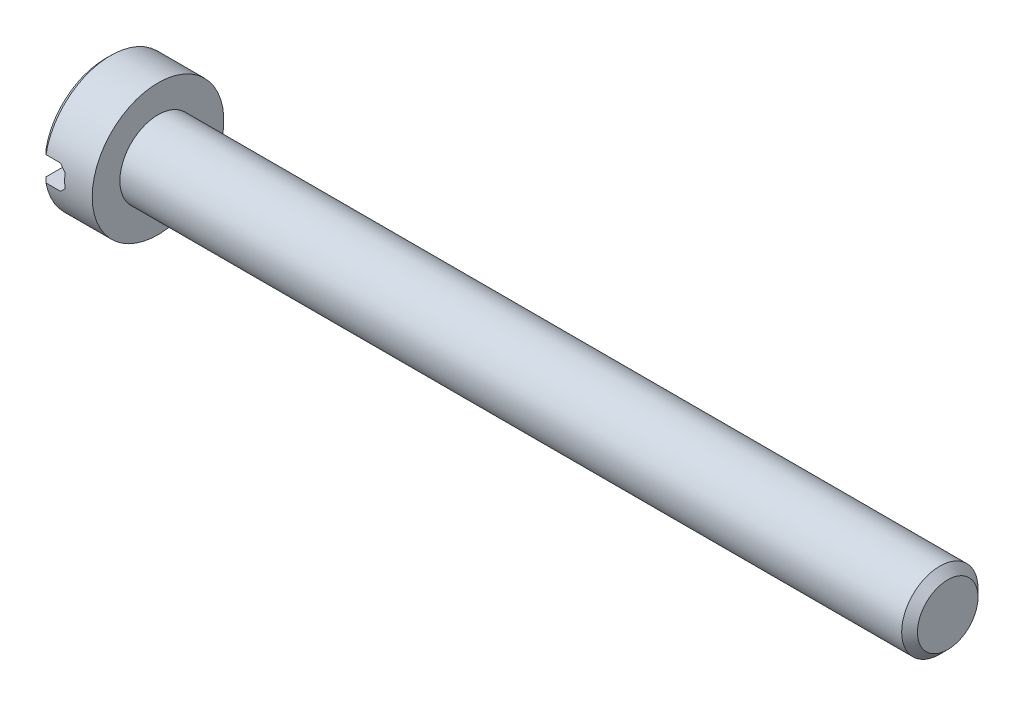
SolidWorks part; units mm, degrees
ref_plane "Face" through (0, 0, 0) normal (0, 0, 1) x (1, 0, 0)
ref_plane "Dessus" through (0, 0, 0) normal (0, 1, 0) x (1, 0, 0)
ref_plane "Droite" through (0, 0, 0) normal (1, 0, 0) x (0, 0, -1)
sketch "Esquisse1" plane through (0, 0, 0) normal (0, 0, 1) x (1, 0, 0)
  line L0 (0, 0) -> (0, 2.3)
  line L1 (0.2, 2.5) -> (2, 2.5)
  line L2 (2, 2.5) -> (2, 0)
  line L5 (0, 0) -> (7.6423, 0) construction
  line L7 (0, 2.3) -> (0.2, 2.5)
  line L8 (0, 0) -> (2, 0)
  point P1 (0, 2.5)
  dimension "D1" = 2.5
  dimension "D3" = 2
revolve "Révolution1" add sketch "Esquisse1" angle 360 about L5
sketch "Esquisse2" plane through (0, 0, 0) normal (0, 0, 1) x (1, 0, 0)
  line L0 (0, 2.3) -> (0, -2.3) construction
  line L1 (0, 0.4655) -> (0.7534, 0.4655)
  line L2 (0, 0.4655) -> (0, -0.4655)
  line L3 (0, -0.4655) -> (0.7534, -0.4655)
  line L4 (0.9534, 0.2655) -> (0.9534, -0.2655)
  line L5 (0.7534, 0.4655) -> (0.9534, 0.2655)
  line L6 (0.7534, -0.4655) -> (0.9534, -0.2655)
  point P1 (0.9534, -0.4655)
  point P3 (0.9534, 0.4655)
extrude "Enlèv. mat.-Extru.1" cut sketch "Esquisse2" against normal mid plane 10
sketch "Esquisse3" plane through (2, 0, 0) normal (1, 0, 0) x (0, 0, -1)
  circle A0 centre (0, 0) radius 1.45
extrude "Extrusion1" add sketch "Esquisse3" along normal blind 30
chamfer "Chanfrein1" distance 0.3 angle 45 1 edges at (32, 0, -1.45)
